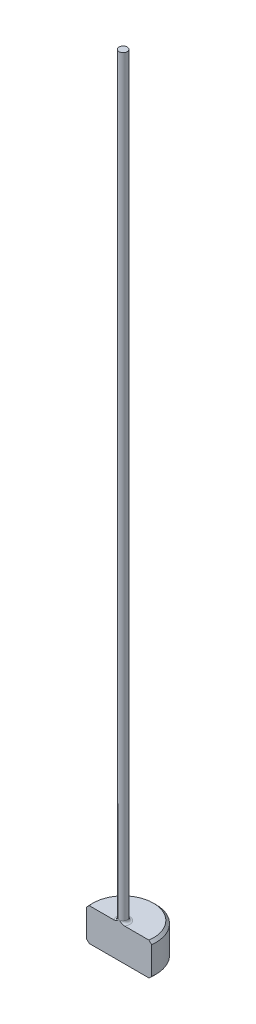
SolidWorks part; units mm, degrees
ref_plane "Front Plane" through (0, 0, 0) normal (0, 0, 1) x (1, 0, 0)
ref_plane "Top Plane" through (0, 0, 0) normal (0, 1, 0) x (1, 0, 0)
ref_plane "Right Plane" through (0, 0, 0) normal (1, 0, 0) x (0, 0, -1)
sketch "Sketch1" plane through (0, 0, 0) normal (0, 0, 1) x (1, 0, 0)
  line L0 (0, 259.9588) -> (0, -15.1925) construction
  line L1 (0, 0) -> (-3.175, 0)
  line L2 (-3.175, 0) -> (-3.175, 3.175)
  line L3 (-3.175, 3.175) -> (-0.3962, 3.175)
  line L4 (-0.3962, 3.175) -> (-0.3962, 76.2)
  line L5 (-0.3962, 76.2) -> (0, 76.2)
  line L6 (0, 76.2) -> (0, 0)
  dimension "L" = 76.2
  dimension "H" = 6.35
  dimension "T" = 3.175
  dimension "D" = 0.7925
revolve "Revolve1" add sketch "Sketch1" angle 360 about L0
chamfer "Chamfer1" distance 0.254 angle 45 2 edges at (0, 3.175, 3.175) (0, 0, 3.175)
fillet "Fillet1" radius 0.254 1 edges at (0, 3.175, 0.3962)
sketch "Sketch2" plane through (0, 0, 0) normal (0, 1, 0) x (1, 0, 0)
  line L0 (-3.1502, -0.3962) -> (3.1502, -0.3962)
  circle A0 centre (0, 0) radius 3.175 construction
  arc A1 (-3.1502, -0.3962) -> (3.1502, -0.3962) centre (0, 0) ccw
  circle A3 centre (0, 0) radius 0.3962 construction
  dimension "D1" = 0
extrude "Key" cut sketch "Sketch2" along normal through all
sketch "Pocket Sketch" plane through (0, 0, 0) normal (0, 0, 1) x (1, 0, 0)
  line L0 (-3.5719, 0) -> (-3.5719, 3.2004)
  line L1 (-3.5719, 3.2004) -> (-1.3567, 3.2004)
  line L2 (-0.5947, 3.9624) -> (-0.5947, 22.225)
  line L3 (-0.5947, 22.225) -> (0, 22.225)
  line L4 (0, 22.225) -> (0, 0)
  line L5 (0, 0) -> (-3.5719, 0)
  line L6 (0, 12.6104) -> (0, -2.4989) construction
  line L7 (-3.175, 2.921) -> (-3.175, 0.254) construction
  line L8 (2.921, 3.175) -> (-2.921, 3.175) construction
  line L9 (-0.3962, 76.2) -> (-0.3962, 3.429) construction
  line L10 (-1.3567, 3.2004) -> (-0.5947, 3.9624)
  point P3 (-0.5947, 3.2004)
  dimension "D1" = 7.1437
  dimension "D2" = 0.3969
  dimension "D3" = 0.0254
  dimension "D4" = 0.1984
  dimension "D5" = 1.1894
  dimension "D6" = 22.225
